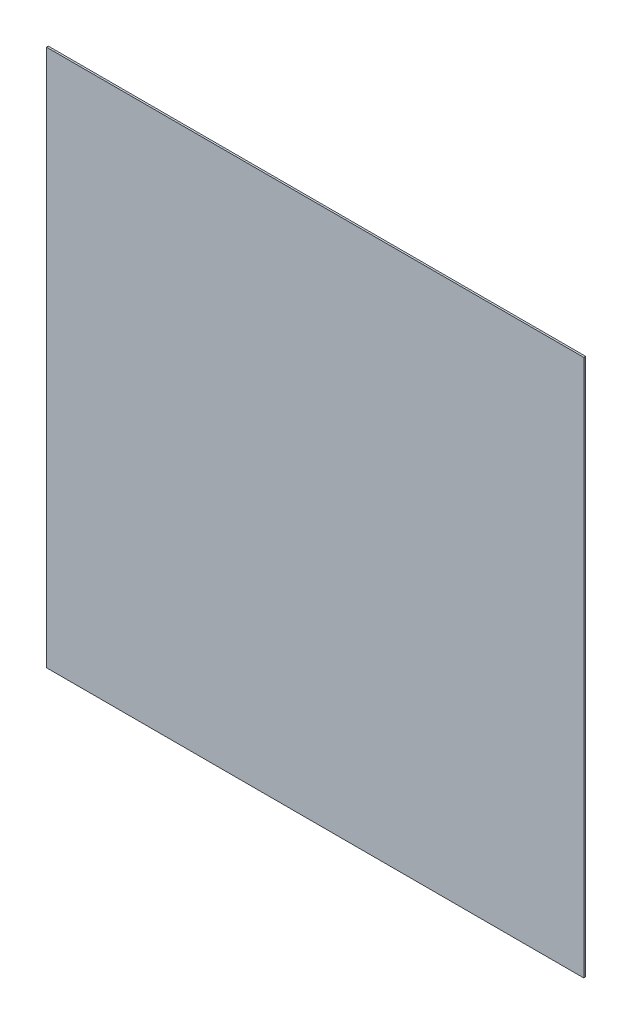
SolidWorks part; units mm, degrees
ref_plane "Plane1" through (0, 0, 0) normal (0, 0, 1) x (1, 0, 0)
ref_plane "Plane2" through (0, 0, 0) normal (0, 1, 0) x (1, 0, 0)
ref_plane "Plane3" through (0, 0, 0) normal (1, 0, 0) x (0, 0, -1)
sketch "Sketch1" plane through (0, 0, 0) normal (0, 0, 1) x (1, 0, 0)
  line L1 (0, 0) -> (457.2, 0)
  line L2 (0, 0) -> (0, 457.2)
  line L3 (0, 457.2) -> (457.2, 457.2)
  line L4 (457.2, 0) -> (457.2, 457.2)
  dimension "D1" = 457.2
  dimension "D2" = 457.2
extrude "Base-Extrude" add sketch "Sketch1" along normal blind 1.5875
